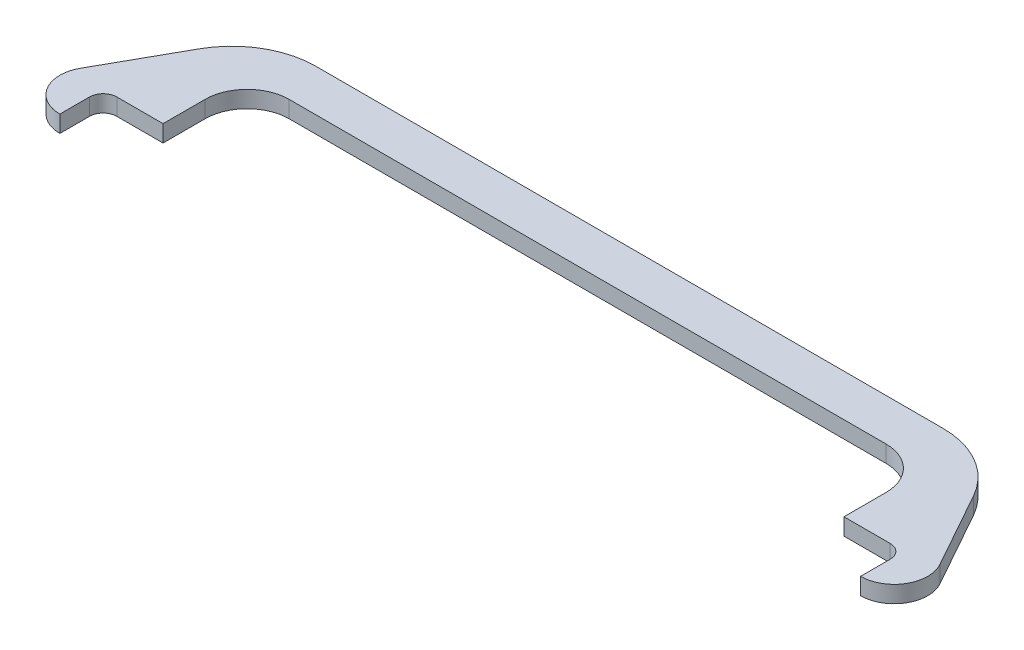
SolidWorks part; units mm, degrees
ref_plane "Plan de face" through (0, 0, 0) normal (0, 0, 1) x (1, 0, 0)
ref_plane "Plan de dessus" through (0, 0, 0) normal (0, 1, 0) x (1, 0, 0)
ref_plane "Plan de droite" through (0, 0, 0) normal (1, 0, 0) x (0, 0, -1)
sketch "Esquisse2" plane through (0, 0, 0) normal (0, 1, 0) x (1, 0, 0)
  line L0 (0, 0) -> (0, 20) construction
  line L1 (-142, 0) -> (142, 0)
  line L2 (162, -20) -> (162, -40)
  line L3 (162, -40) -> (184, -40)
  line L4 (190.5, -46.5) -> (190.5, -60.6)
  line L5 (204.4668, -36.7942) -> (184.1745, -0.4856)
  line L6 (149.2577, 20) -> (-149.2577, 20)
  line L7 (-204.4668, -36.7942) -> (-184.1745, -0.4856)
  line L8 (-190.5, -46.5) -> (-190.5, -60.6)
  line L9 (-162, -40) -> (-184, -40)
  line L10 (-162, -20) -> (-162, -40)
  arc A0 (190.5, -60.6) -> (204.4668, -36.7942) centre (190.5, -44.6) ccw
  arc A1 (184.1745, -0.4856) -> (149.2577, 20) centre (149.2577, -20) ccw
  arc A2 (162, -20) -> (142, 0) centre (142, -20) ccw
  arc A3 (190.5, -46.5) -> (184, -40) centre (184, -46.5) ccw
  arc A4 (-190.5, -46.5) -> (-184, -40) centre (-184, -46.5) cw
  arc A5 (-162, -20) -> (-142, 0) centre (-142, -20) cw
  arc A6 (-184.1745, -0.4856) -> (-149.2577, 20) centre (-149.2577, -20) cw
  arc A7 (-190.5, -60.6) -> (-204.4668, -36.7942) centre (-190.5, -44.6) cw
  dimension "D6" = 40
  dimension "D7" = 20
  dimension "D8" = 6.5
  dimension "D9" = 16
  dimension "D1" = 20
  dimension "D2" = 381
  dimension "D3" = 324
  dimension "D4" = 40
  dimension "D5" = 60.6
  dimension "D10" = 29.2
extrude "Extrusion1" add sketch "Esquisse2" along normal blind 8
